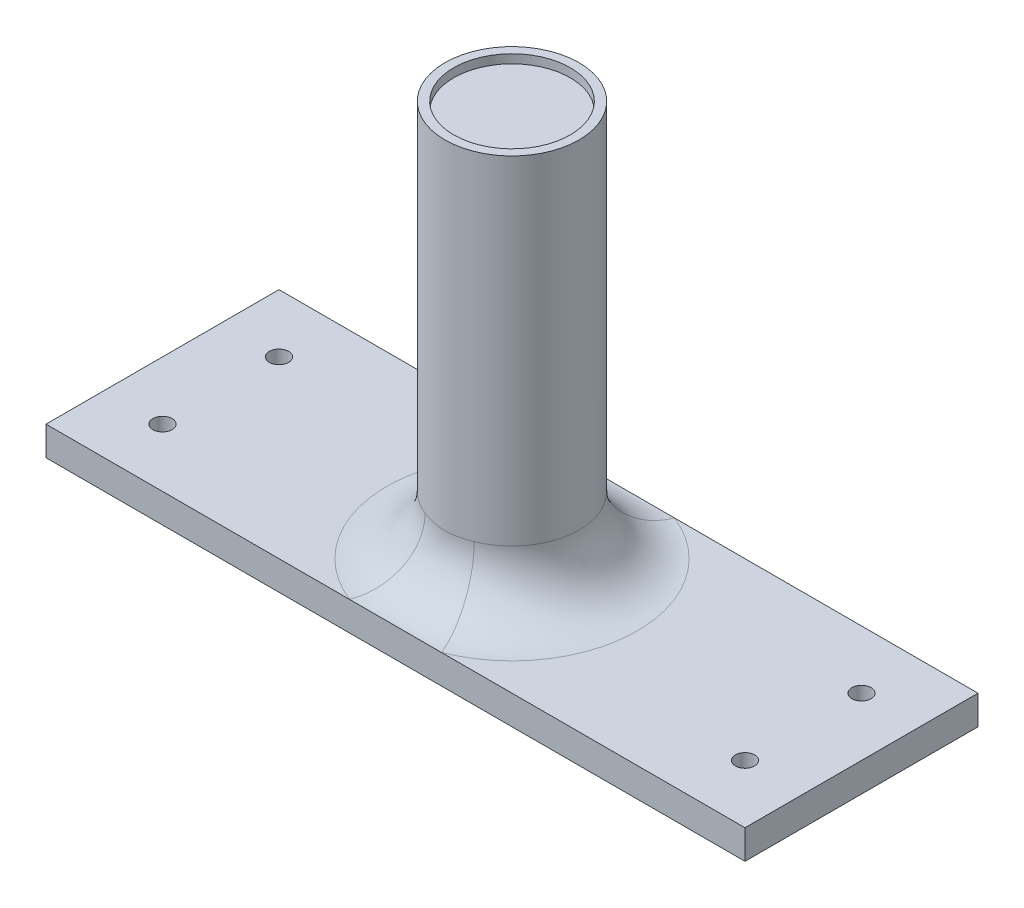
SolidWorks part; units mm, degrees
ref_plane "Alzado" through (0, 0, 0) normal (0, 0, 1) x (1, 0, 0)
ref_plane "Planta" through (0, 0, 0) normal (0, 1, 0) x (1, 0, 0)
ref_plane "Vista lateral" through (0, 0, 0) normal (1, 0, 0) x (0, 0, -1)
sketch "Croquis1" plane through (0, 0, 0) normal (0, 1, 0) x (1, 0, 0)
  line L0 (-50, -10) -> (-23.8079, -10) construction
  line L1 (-60, -20) -> (60, -20)
  line L2 (-60, -20) -> (-60, 20)
  line L3 (-60, 20) -> (60, 20)
  line L4 (60, -20) -> (60, 20)
  line L5 (-60, -20) -> (60, 20) construction
  line L6 (-60, 20) -> (60, -20) construction
  line L7 (-50, 10) -> (50, 10) construction
  circle A0 centre (-50, 10) radius 1.65
  circle A1 centre (50, 10) radius 1.65
  circle A2 centre (50, -10) radius 1.65
  circle A3 centre (-50, -10) radius 1.65
  point P0 (0, 0)
  dimension "D3" = 10
  dimension "D7" = 3.3
  dimension "D8" = 3.3
  dimension "D9" = 3.3
  dimension "D10" = 3.3
  dimension "D1" = 120
  dimension "D2" = 40
  dimension "D4" = 10
  dimension "D5" = 10
  dimension "D6" = 10
  dimension "D11" = 10
  dimension "D12" = 10
extrude "Saliente-Extruir1" add sketch "Croquis1" along normal blind 5
sketch "Croquis2" plane through (0, 5, 0) normal (0, 1, 0) x (1, 0, 0)
  circle A0 centre (0, 0) radius 11.5
  dimension "D1" = 23
extrude "Saliente-Extruir2" add sketch "Croquis2" along normal blind 68
fillet "Redondeo1" radius 10 1 edges at (0, 5, 11.5)
sketch "Croquis3" plane through (0, 73, 0) normal (0, 1, 0) x (1, 0, 0)
  circle A0 centre (0, 0) radius 10
  dimension "D1" = 20
extrude "Cortar-Extruir1" cut sketch "Croquis3" against normal blind 1.5
